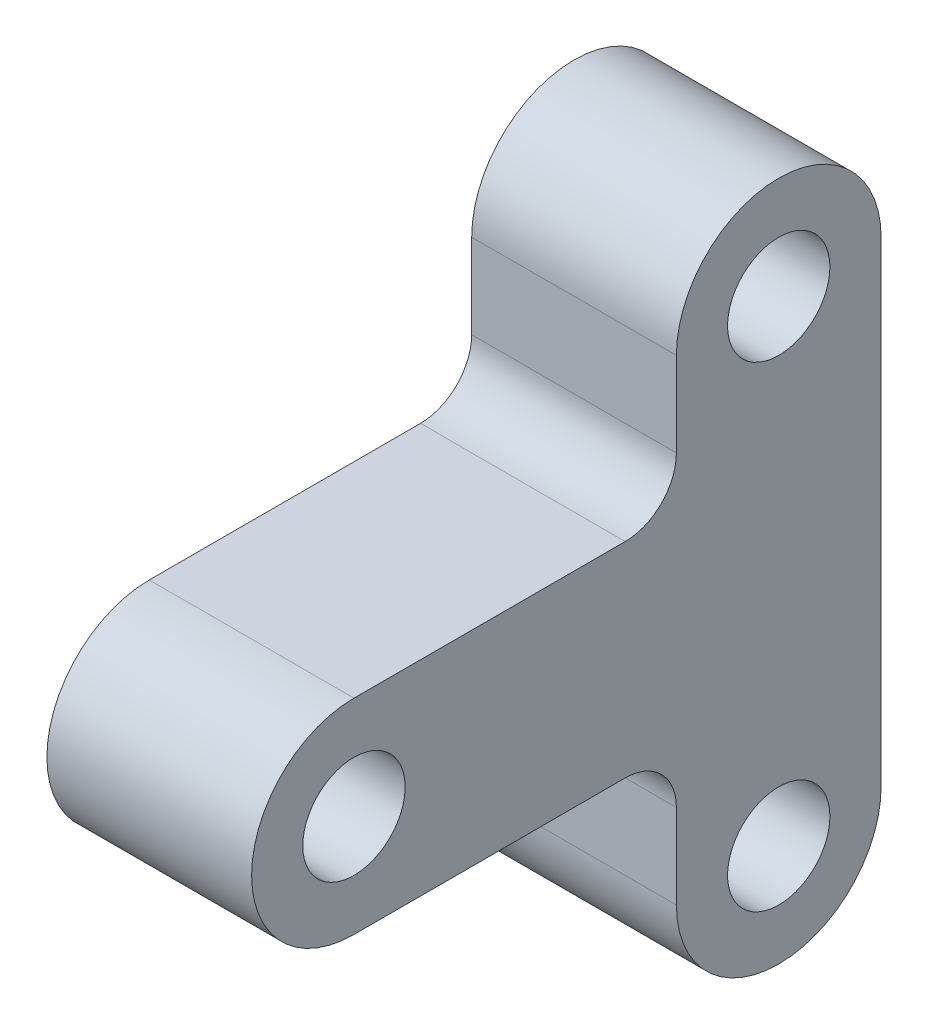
SolidWorks part; units mm, degrees
ref_plane "Front Plane" through (0, 0, 0) normal (0, 0, 1) x (1, 0, 0)
ref_plane "Top Plane" through (0, 0, 0) normal (0, 1, 0) x (1, 0, 0)
ref_plane "Right Plane" through (0, 0, 0) normal (1, 0, 0) x (0, 0, -1)
sketch "Sketch1" plane through (0, 0, 0) normal (1, 0, 0) x (0, 0, -1)
  line L0 (0, 0) -> (0, 46.5) construction
  line L1 (10, 0) -> (10, 8.25)
  line L2 (-10, 0) -> (-10, 8.25)
  line L3 (0, 46.5) -> (41.5, 23.25) construction
  line L4 (41.5, 23.25) -> (0, 0) construction
  line L5 (41.5, 23.25) -> (0, 23.25) construction
  line L6 (15, 33.25) -> (41.5, 33.25) construction
  line L7 (-41.5, 13.25) -> (-15, 13.25)
  line L8 (41.5, 13.25) -> (15, 13.25) construction
  line L9 (10, 38.25) -> (10, 46.5)
  line L10 (10, 0) -> (10, 46.5) construction
  line L11 (-15, 33.25) -> (-41.5, 33.25)
  line L12 (10, 38.25) -> (10, 8.25)
  line L13 (-10, 38.25) -> (-10, 46.5)
  line L14 (-10, 0) -> (-10, 46.5) construction
  arc A0 (10, 0) -> (-10, 0) centre (0, 0) cw
  arc A1 (10, 46.5) -> (-10, 46.5) centre (0, 46.5) ccw
  circle A2 centre (0, 46.5) radius 5
  circle A3 centre (0, 0) radius 5
  arc A4 (41.5, 33.25) -> (41.5, 13.25) centre (41.5, 23.25) cw construction
  circle A5 centre (41.5, 23.25) radius 5 construction
  arc A6 (15, 33.25) -> (10, 38.25) centre (15, 38.25) cw construction
  arc A7 (10, 8.25) -> (15, 13.25) centre (15, 8.25) cw construction
  arc A8 (-10, 8.25) -> (-15, 13.25) centre (-15, 8.25) ccw
  circle A9 centre (-41.5, 23.25) radius 5
  arc A10 (-41.5, 33.25) -> (-41.5, 13.25) centre (-41.5, 23.25) ccw
  arc A11 (-15, 33.25) -> (-10, 38.25) centre (-15, 38.25) ccw
  point P18 (10, 33.25)
  point P31 (0, 0)
  point P32 (0, 0)
  dimension "D4" = 10
  dimension "D6" = 10
  dimension "D7" = 10
  dimension "D8" = 5
  dimension "D5" = 41.5
  dimension "D3" = 46.5
  dimension "D1" = 10
  dimension "D2" = 10
extrude "Extrude1" add sketch "Sketch1" along normal mid plane 20
